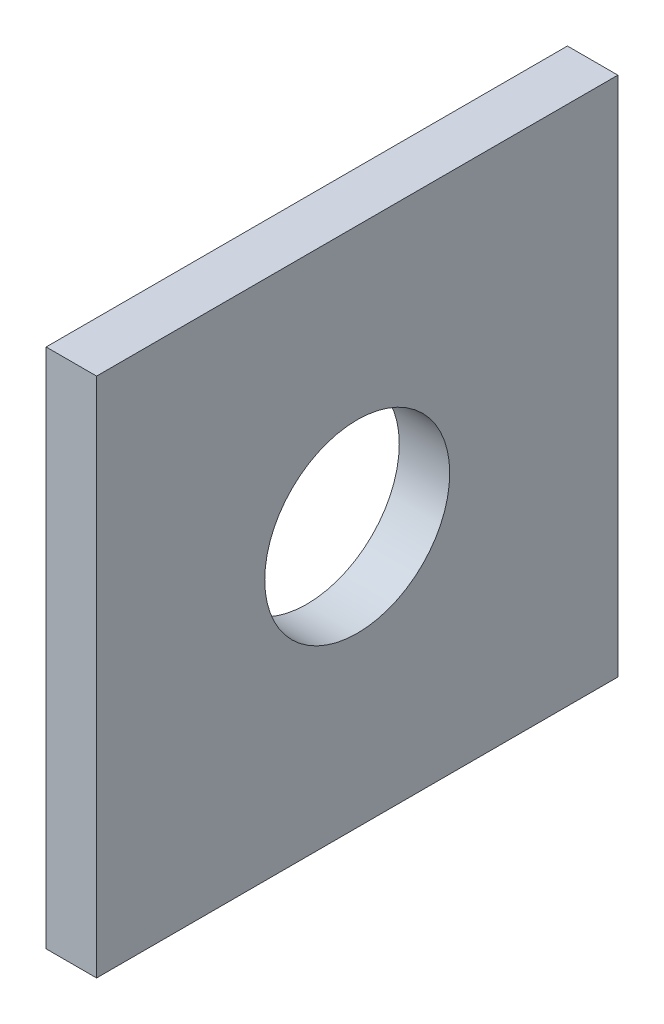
SolidWorks part; units mm, degrees
ref_plane "Plane1" through (0, 0, 0) normal (0, 0, 1) x (1, 0, 0)
ref_plane "Plane2" through (0, 0, 0) normal (0, 1, 0) x (1, 0, 0)
ref_plane "Plane3" through (0, 0, 0) normal (1, 0, 0) x (0, 0, -1)
other "Configuration Table"
sketch "Sketch1" plane through (0, 0, 0) normal (1, 0, 0) x (0, 0, -1)
  line L0 (-44.45, 0) -> (41.275, 0) construction
  line L1 (-31, -31) -> (31, -31)
  line L2 (-31, -31) -> (-31, 31)
  line L3 (-31, 31) -> (31, 31)
  line L4 (31, -31) -> (31, 31)
  line L5 (0, 41.275) -> (0, -38.1) construction
  circle A0 centre (0, 0) radius 11
  dimension "Inside_dia" = 22
  dimension "Outside_dia" = 62
extrude "Body" add sketch "Sketch1" against normal blind 6
